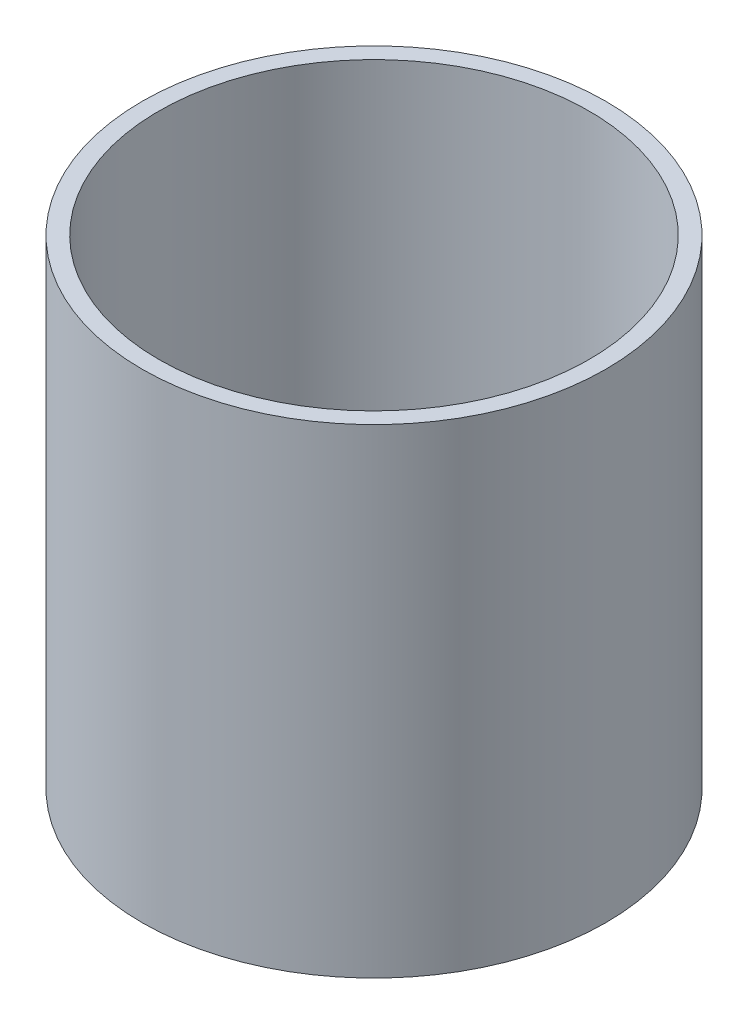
SolidWorks part; units mm, degrees
ref_plane "Front Plane" through (0, 0, 0) normal (0, 0, 1) x (1, 0, 0)
ref_plane "Top Plane" through (0, 0, 0) normal (0, 1, 0) x (1, 0, 0)
ref_plane "Right Plane" through (0, 0, 0) normal (1, 0, 0) x (0, 0, -1)
sketch "Sketch1" plane through (0, 0, 0) normal (0, 1, 0) x (1, 0, 0)
  circle A0 centre (0, 0) radius 13.827
  circle A1 centre (0, 0) radius 12.827
  dimension "D1" = 25.654
  dimension "D2" = 1
extrude "Boss-Extrude1" add sketch "Sketch1" along normal blind 28.575
